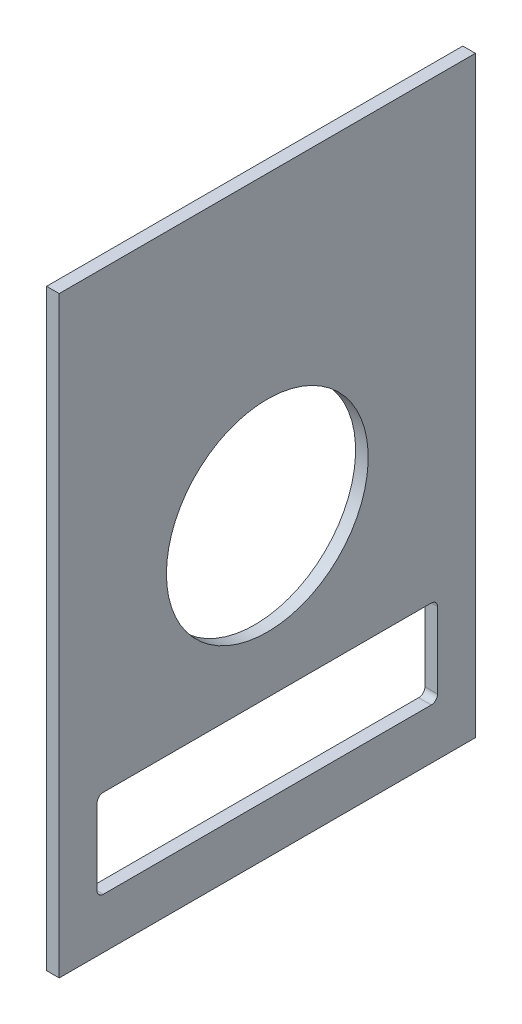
SolidWorks part; units mm, degrees
ref_plane "Front" through (0, 0, 0) normal (0, 0, 1) x (1, 0, 0)
ref_plane "Top" through (0, 0, 0) normal (0, 1, 0) x (1, 0, 0)
ref_plane "Right" through (0, 0, 0) normal (1, 0, 0) x (0, 0, -1)
sketch "Sketch1" plane through (0, 0, 0) normal (1, 0, 0) x (0, 0, -1)
  line L0 (-209.55, 298.45) -> (209.55, -298.45) construction
  line L1 (-209.55, 298.45) -> (209.55, 298.45)
  line L2 (-209.55, 298.45) -> (-209.55, -298.45)
  line L3 (-209.55, -298.45) -> (209.55, -298.45)
  line L4 (209.55, 298.45) -> (209.55, -298.45)
  point P4 (0, 0)
  dimension "D1" = 419.1
  dimension "D3" = 596.9
extrude "Extrude1" add sketch "Sketch1" along normal blind 12.7
sketch "Sketch2" plane through (0, 0, 0) normal (-1, 0, 0) x (0, 0, 1)
  line L0 (209.55, -298.45) -> (-209.55, -298.45) construction
  line L1 (-171.45, -158.75) -> (171.45, -158.75)
  line L2 (-171.45, -158.75) -> (-171.45, -247.65)
  line L3 (-171.45, -247.65) -> (171.45, -247.65)
  line L4 (171.45, -158.75) -> (171.45, -247.65)
  line L5 (-209.55, -298.45) -> (-209.55, 298.45) construction
  line L6 (209.55, 298.45) -> (209.55, -298.45) construction
  circle A0 centre (0, 0) radius 101.6
  dimension "D5" = 203.2
  dimension "D1" = 50.8
  dimension "D2" = 88.9
  dimension "D3" = 38.1
  dimension "D4" = 38.1
extrude "Cut-Extrude1" cut sketch "Sketch2" against normal through all
fillet "Fillet1" radius 6.35 4 edges at (6.35, -158.75, -171.45) (6.35, -247.65, 171.45) (6.35, -158.75, 171.45) (6.35, -247.65, -171.45)
